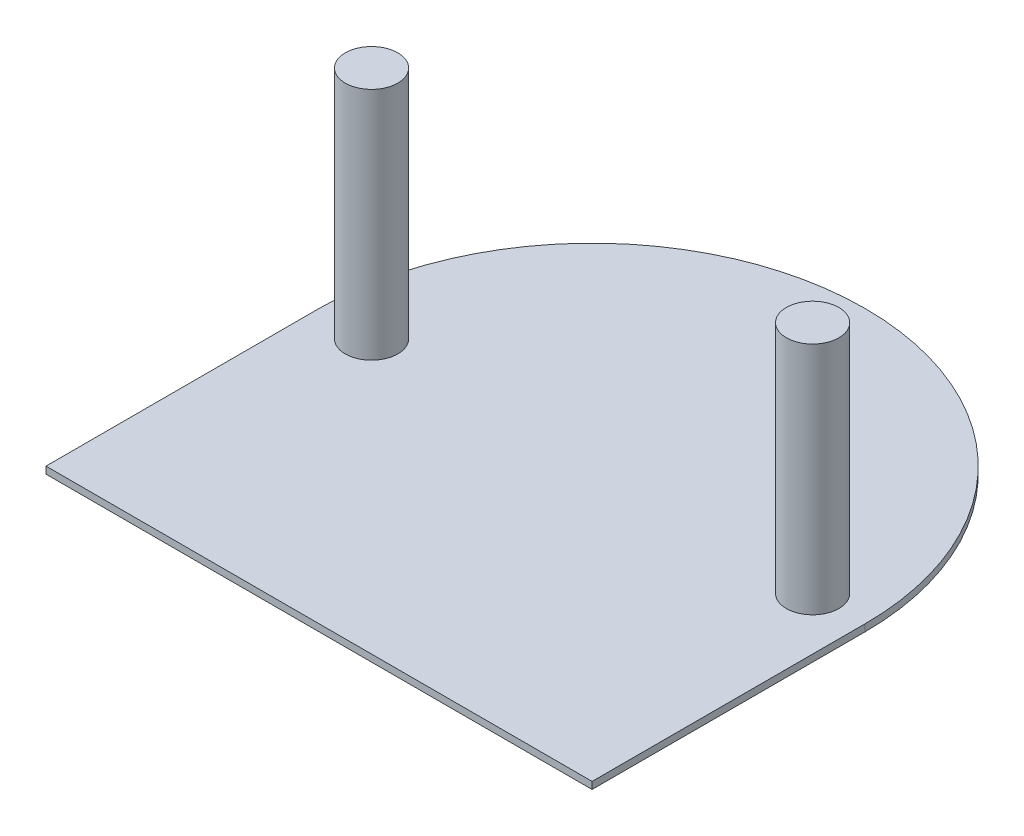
SolidWorks part; units mm, degrees
ref_plane "Front Plane" through (0, 0, 0) normal (0, 0, 1) x (1, 0, 0)
ref_plane "Top Plane" through (0, 0, 0) normal (0, 1, 0) x (1, 0, 0)
ref_plane "Right Plane" through (0, 0, 0) normal (1, 0, 0) x (0, 0, -1)
sketch "Sketch1" plane through (0, 0, 0) normal (0, 1, 0) x (1, 0, 0)
  line L1 (-99.06, 0) -> (99.06, 0)
  line L2 (-99.06, 0) -> (-99.06, -99.06)
  line L3 (-99.06, -99.06) -> (99.06, -99.06)
  line L4 (99.06, 0) -> (99.06, -99.06)
  circle A0 centre (0, 0) radius 99.06
  dimension "D1" = 198.12
extrude "Boss-Extrude1" add sketch "Sketch1" along normal blind 2.54 contours L1 A0 | A0 L1 | A0 L2 L3 | A0 L3 L4
sketch "Sketch2" plane through (0, 2.54, 0) normal (0, 1, 0) x (1, 0, 0)
  line L0 (0, -99.06) -> (0, 99.06) construction
  line L1 (-99.06, -99.06) -> (99.06, -99.06) construction
  line L2 (0, 0) -> (-38.4948, -22.225) construction
  line L3 (0, 0) -> (38.4948, -22.225) construction
  line L4 (0, 0) -> (-80.01, 0) construction
  line L5 (0, 0) -> (80.01, 0) construction
  line L6 (-99.06, 0) -> (-99.06, -99.06) construction
  arc A0 (99.06, 0) -> (-99.06, 0) centre (0, 0) ccw construction
  circle A5 centre (-80.01, 0) radius 6.35
  circle A6 centre (80.01, 0) radius 6.35
  dimension "D7" = 12.7
  dimension "D2" = 120
  dimension "D3" = 120
  dimension "D4" = 44.45
  dimension "D6" = 19.05
extrude "Cut-Extrude1" cut sketch "Sketch2" against normal through all
sketch "Sketch3" plane through (0, 2.54, 0) normal (0, 1, 0) x (1, 0, 0)
  circle A0 centre (-80.01, 0) radius 9.525
  circle A1 centre (80.01, 0) radius 9.525
  circle A2 centre (-80.01, 0) radius 6.35
  circle A3 centre (80.01, 0) radius 6.35
  circle A4 centre (-80.01, 0) radius 6.35 construction
  dimension "D1" = 19.05
  dimension "D2" = 12.7
extrude "Boss-Extrude2" add sketch "Sketch3" along normal blind 82.55
sketch "Sketch4" plane through (0, 85.09, 0) normal (0, 1, 0) x (1, 0, 0)
  circle A0 centre (-80.01, 0) radius 9.525
  circle A1 centre (80.01, 0) radius 9.525
  circle A2 centre (80.01, 0) radius 9.525 construction
extrude "Boss-Extrude3" add sketch "Sketch4" along normal blind 2.54
